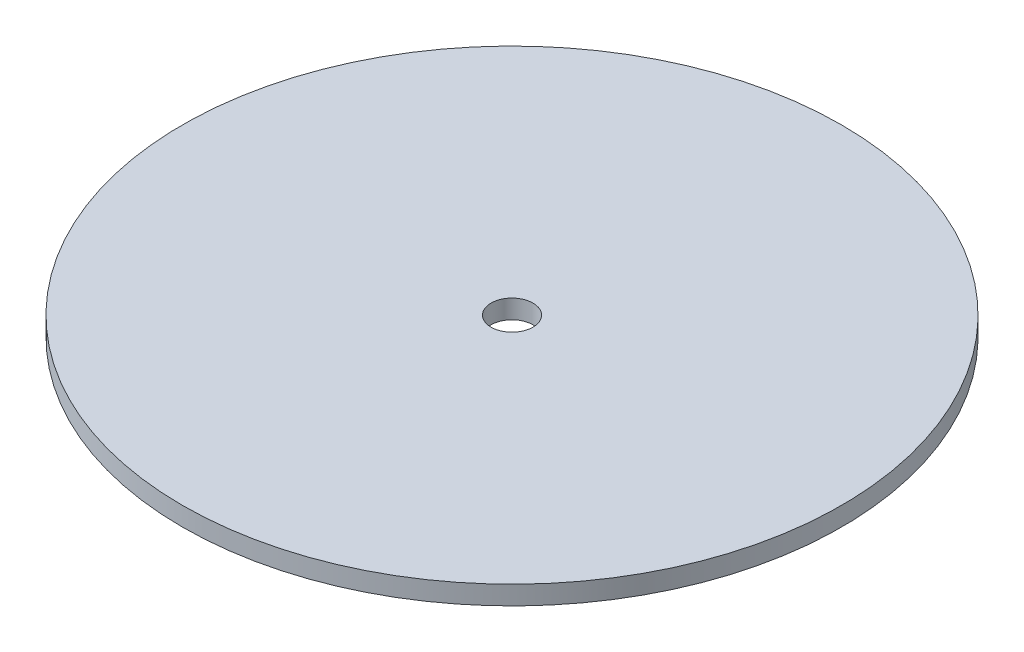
SolidWorks part; units mm, degrees
ref_plane "Front Plane" through (0, 0, 0) normal (0, 0, 1) x (1, 0, 0)
ref_plane "Top Plane" through (0, 0, 0) normal (0, 1, 0) x (1, 0, 0)
ref_plane "Right Plane" through (0, 0, 0) normal (1, 0, 0) x (0, 0, -1)
sketch "Sketch1" plane through (0, 0, 0) normal (0, 1, 0) x (1, 0, 0)
  circle A0 centre (0, 0) radius 31.5
  circle A3 centre (0, 0) radius 2
  dimension "D1" = 63
  dimension "D2" = 4
extrude "Boss-Extrude1" add sketch "Sketch1" along normal mid plane 1.8
